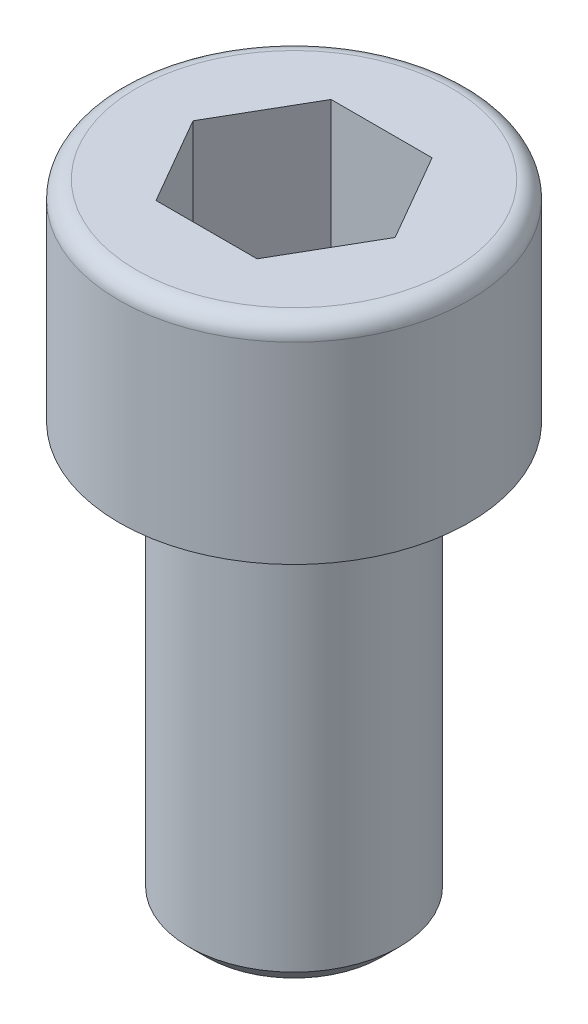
SolidWorks part; units mm, degrees
ref_plane "Plan1" through (0, 0, 0) normal (0, 0, 1) x (1, 0, 0)
ref_plane "Plan2" through (0, 0, 0) normal (0, 1, 0) x (1, 0, 0)
ref_plane "Plan3" through (0, 0, 0) normal (1, 0, 0) x (0, 0, -1)
sketch "Esquisse1" plane through (0, 0, 0) normal (0, 0, 1) x (1, 0, 0)
  line L0 (0, 50) -> (0, -40) construction
  line L1 (0, 18) -> (-4.5, 18)
  line L3 (-5, 17.5) -> (-5, 12)
  line L4 (-5, 12) -> (-3, 12)
  line L7 (-3, 12) -> (-3, 0)
  line L12 (-3, 0) -> (0, 0)
  line L13 (0, 18) -> (0, 0)
  arc A0 (-5, 17.5) -> (-4.5, 18) centre (-4.5, 17.5) cw
  dimension "D1" = 0.5
  dimension "D2" = 5
  dimension "D3" = 12
  dimension "D4" = 6
  dimension "D7" = 3
revolve "Base-Révolution" add sketch "Esquisse1" angle 360 about L0
sketch "Esquisse2" plane through (0, 18, 0) normal (0, 1, 0) x (-1, 0, 0)
  line L0 (-2.8868, 0) -> (2.8868, 0) construction
  line L1 (-1.4434, -2.5) -> (1.4434, 2.5) construction
  line L2 (1.4434, -2.5) -> (-1.4434, 2.5) construction
  line L3 (1.4434, -2.5) -> (-1.4434, -2.5)
  line L4 (-1.4434, -2.5) -> (-2.8868, 0)
  line L5 (-2.8868, 0) -> (-1.4434, 2.5)
  line L6 (-1.4434, 2.5) -> (1.4434, 2.5)
  line L7 (1.4434, 2.5) -> (2.8868, 0)
  line L8 (2.8868, 0) -> (1.4434, -2.5)
  dimension "D1" = 5
extrude "Enlèv. mat.-Extru.1" cut sketch "Esquisse2" against normal blind 4
chamfer "Chanfrein1" distance 0.5 angle 45
